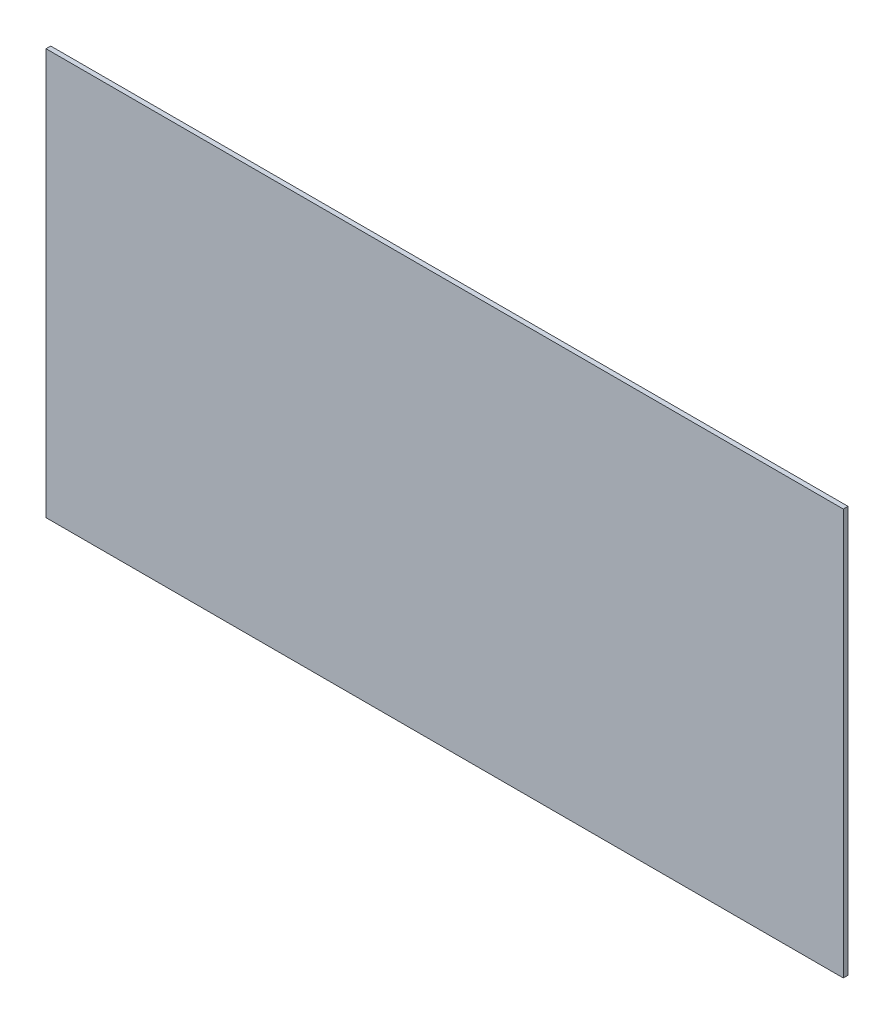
SolidWorks part; units mm, degrees
ref_plane "Plan de face" through (0, 0, 0) normal (0, 0, 1) x (1, 0, 0)
ref_plane "Plan de dessus" through (0, 0, 0) normal (0, 1, 0) x (1, 0, 0)
ref_plane "Plan de droite" through (0, 0, 0) normal (1, 0, 0) x (0, 0, -1)
sketch "Esquisse1" plane through (0, 0, 0) normal (0, 0, 1) x (1, 0, 0)
  line L1 (-254.8, -129.8) -> (254.8, -129.8)
  line L2 (-254.8, -129.8) -> (-254.8, 129.8)
  line L3 (-254.8, 129.8) -> (254.8, 129.8)
  line L4 (254.8, -129.8) -> (254.8, 129.8)
  line L5 (-254.8, -129.8) -> (254.8, 129.8) construction
  line L6 (-254.8, 129.8) -> (254.8, -129.8) construction
  point P0 (0, 0)
extrude "Boss.-Extru.1" add sketch "Esquisse1" along normal blind 3 contours L2 L3 L4 L1
